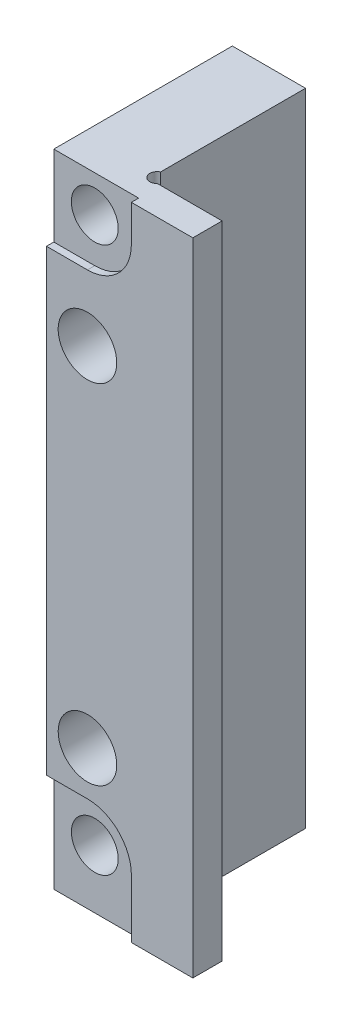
SolidWorks part; units mm, degrees
ref_plane "前基準面" through (0, 0, 0) normal (0, 0, 1) x (1, 0, 0)
ref_plane "上基準面" through (0, 0, 0) normal (0, 1, 0) x (1, 0, 0)
ref_plane "右基準面" through (0, 0, 0) normal (1, 0, 0) x (0, 0, -1)
sketch "草圖1" plane through (0, 0, 0) normal (0, 0, 1) x (1, 0, 0)
  line L0 (-29.9, 26.9) -> (-29.9, -26.9) construction
  line L1 (-38, 30) -> (38, 30) construction
  line L2 (-38, 30) -> (-38, -30) construction
  line L3 (-38, -30) -> (38, -30) construction
  line L4 (38, 30) -> (38, -30) construction
  line L5 (-38, 30) -> (38, -30) construction
  line L6 (-38, -30) -> (38, 30) construction
  line L7 (-29.9, 26.9) -> (29.9, 26.9) construction
  line L8 (-34.9, 21.9) -> (-34.9, -21.9) construction
  line L9 (-29.9, -26.9) -> (29.9, -26.9) construction
  line L10 (34.9, 21.9) -> (34.9, -21.9) construction
  line L11 (-34.9, 26.9) -> (34.9, -26.9) construction
  line L12 (-34.9, -26.9) -> (34.9, 26.9) construction
  line L13 (-34.9, 21.9) -> (-24.9, 21.9)
  line L14 (-24.9, 21.9) -> (-24.9, -21.9)
  line L15 (-24.9, -21.9) -> (-34.9, -21.9)
  line L16 (-34.9, 21.9) -> (-34.9, -21.9)
  arc A0 (29.9, -26.9) -> (34.9, -21.9) centre (29.9, -21.9) ccw construction
  arc A1 (29.9, 26.9) -> (34.9, 21.9) centre (29.9, 21.9) cw construction
  arc A2 (-34.9, -21.9) -> (-29.9, -26.9) centre (-29.9, -21.9) ccw construction
  arc A3 (-29.9, 26.9) -> (-34.9, 21.9) centre (-29.9, 21.9) ccw construction
  point P0 (0, 0)
  point P6 (0, 0)
  dimension "D5" = 5
  dimension "D1" = 76
  dimension "D2" = 60
  dimension "D3" = 3.1
  dimension "D4" = 3.1
  dimension "D6" = 5
  dimension "D7" = 10
extrude "填料-伸長1" add sketch "草圖1" against normal blind 10
sketch "草圖2" plane through (0, -21.9, 0) normal (0, -1, 0) x (1, 0, 0)
  line L0 (-24.9, -10) -> (-24.9, -2)
  line L1 (-24.9, -10) -> (-24.9, 0) construction
  line L2 (-24.9, -2) -> (-29.9, -2)
  line L3 (-29.9, -2) -> (-29.9, -10)
  line L4 (-34.9, -10) -> (-24.9, -10) construction
  line L5 (-29.9, -10) -> (-24.9, -10)
  line L6 (-27.4, -2) -> (-27.4, -10) construction
  line L7 (-29.9, -6) -> (-24.9, -6) construction
  line L8 (-27.4, -6) -> (-29.9, -2) construction
  circle A0 centre (-29.684, -2.3456) radius 0.5
  dimension "D3" = 1
  dimension "D4" = 0.3456
  dimension "D1" = 8
  dimension "D2" = 5
extrude "除料-伸長1" cut sketch "草圖2" against normal through all
sketch "草圖3" plane through (0, 0, 0) normal (0, 0, 1) x (1, 0, 0)
  line L0 (-34.9, -21.9) -> (-24.9, -21.9) construction
  line L1 (-34.9, 21.9) -> (-34.9, -21.9) construction
  line L2 (-24.9, 21.9) -> (-34.9, 21.9) construction
  circle A0 centre (-32.1, -17.9) radius 1.6
  circle A1 centre (-32.1, 19.4) radius 1.6
  dimension "D1" = 3.2
  dimension "D4" = 3.2
  dimension "D2" = 4
  dimension "D3" = 2.8
  dimension "D5" = 2.5
  dimension "D6" = 2.8
extrude "除料-伸長2" cut sketch "草圖3" against normal through all
sketch "草圖4" plane through (0, 0, 0) normal (0, 0, 1) x (1, 0, 0)
  line L0 (-34.9, 21.9) -> (-34.9, -21.9) construction
  line L1 (-24.9, 21.9) -> (-34.9, 21.9) construction
  line L2 (-34.9, 0) -> (-24.9, 0) construction
  line L3 (-24.9, -21.9) -> (-24.9, 21.9) construction
  circle A0 centre (-32.1, 11.9) radius 2
  circle A1 centre (-32.1, -11.9) radius 2
  dimension "D1" = 2.8
  dimension "D3" = 4
  dimension "D2" = 10
extrude "除料-伸長3" cut sketch "草圖4" against normal through all
sketch "草圖5" plane through (0, 0, 0) normal (0, 0, 1) x (1, 0, 0)
  line L0 (-29.1, 19.4) -> (-29.1, 21.9)
  line L1 (-24.9, 21.9) -> (-34.9, 21.9) construction
  line L2 (-32.1, 16.4) -> (-34.9, 16.4)
  line L3 (-34.9, 21.9) -> (-34.9, -21.9) construction
  line L4 (-34.9, 16.4) -> (-34.9, 21.9)
  line L5 (-34.9, 21.9) -> (-29.1, 21.9)
  line L6 (-32.1, -14.9) -> (-34.9, -14.9)
  line L7 (-29.1, -17.9) -> (-29.1, -21.9)
  line L10 (-29.1, -21.9) -> (-34.9, -21.9)
  line L11 (-34.9, -21.9) -> (-34.9, -14.9)
  circle A0 centre (-32.1, 19.4) radius 3 construction
  arc A1 (-29.1, 19.4) -> (-32.1, 16.4) centre (-32.1, 19.4) cw
  circle A2 centre (-32.1, -17.9) radius 3 construction
  arc A3 (-32.1, -14.9) -> (-29.1, -17.9) centre (-32.1, -17.9) cw
  circle A4 centre (-32.1, -11.9) radius 2 construction
  dimension "D1" = 6
  dimension "D2" = 6
  dimension "D3" = 6
extrude "除料-伸長4" cut sketch "草圖5" against normal blind 0.5
sketch "草圖6" plane through (0, 0, -10) normal (0, 0, -1) x (-1, 0, 0)
  line L4 (29.9, 21.9) -> (29.9, -21.9)
  line L5 (29.9, -21.9) -> (34.9, -21.9)
  line L6 (34.9, -21.9) -> (34.9, 21.9)
  line L7 (34.9, 21.9) -> (29.9, 21.9)
  line L8 (29.9, 21.9) -> (29.9, -21.9)
  line L9 (29.9, -21.9) -> (34.9, -21.9)
  line L10 (34.9, -21.9) -> (34.9, 21.9)
  line L11 (34.9, 21.9) -> (29.9, 21.9)
  circle A1 centre (32.1, 11.9) radius 2
  circle A2 centre (32.1, 11.9) radius 2
  circle A3 centre (32.1, -11.9) radius 2
  circle A4 centre (32.1, -11.9) radius 2
  circle A5 centre (32.1, -17.9) radius 1.6
  circle A6 centre (32.1, -17.9) radius 1.6
  circle A7 centre (32.1, 19.4) radius 1.6
  circle A8 centre (32.1, 19.4) radius 1.6
  dimension "D1" = 0
  dimension "D2" = 0
  dimension "D3" = 0
  dimension "D4" = 0
  dimension "D5" = 0
extrude "填料-伸長2" add sketch "草圖6" along normal blind 2.7
